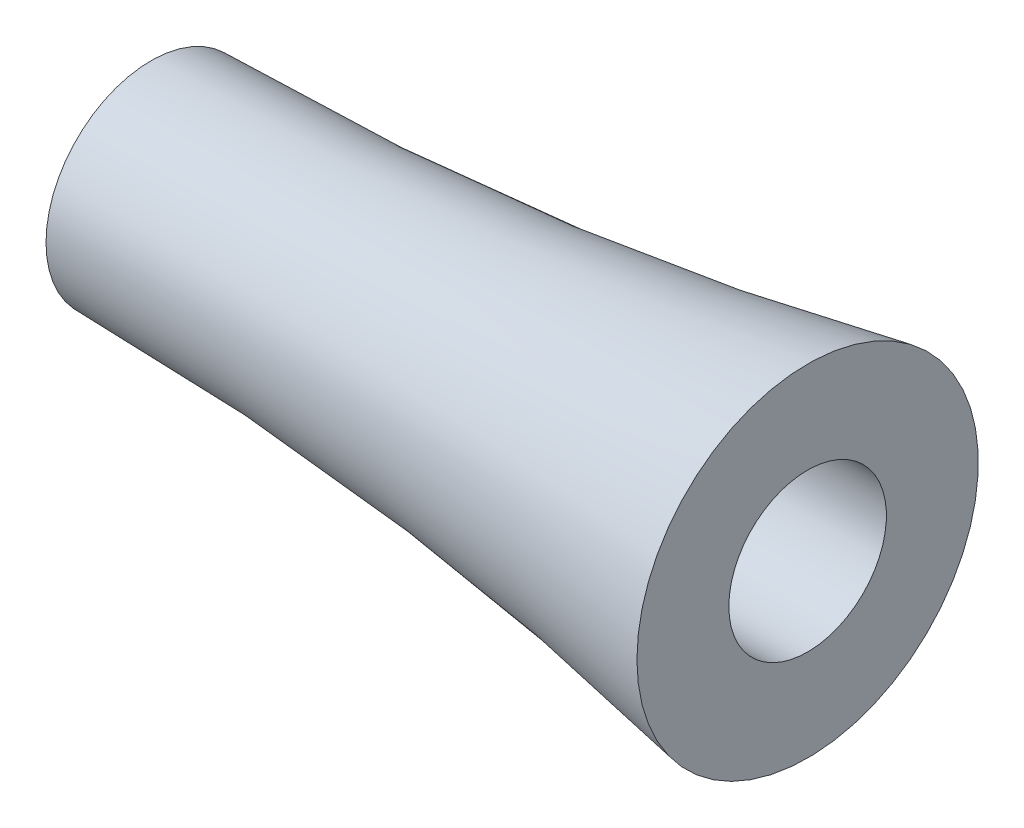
SolidWorks part; units mm, degrees
ref_plane "Plan de face" through (0, 0, 0) normal (0, 0, 1) x (1, 0, 0)
ref_plane "Plan de dessus" through (0, 0, 0) normal (0, 1, 0) x (1, 0, 0)
ref_plane "Plan de droite" through (0, 0, 0) normal (1, 0, 0) x (0, 0, -1)
sketch "Esquisse1" plane through (0, 0, 0) normal (0, 0, 1) x (1, 0, 0)
  line L0 (-18.3711, 0) -> (6.6289, 0)
  line L1 (-18.3711, 0) -> (-18.3711, 1)
  line L2 (6.6289, 0) -> (6.6289, 3.5)
  line L3 (-18.3711, 0) -> (-18.3711, -3)
  line L4 (-18.3711, -3) -> (6.6289, -3)
  line L5 (6.6289, -3) -> (6.6289, 0)
  arc A0 (-18.3711, 1) -> (6.6289, 3.5) centre (-18.3711, 127.25) ccw
revolve "Révolution1" add sketch "Esquisse1" angle 360 about L4
